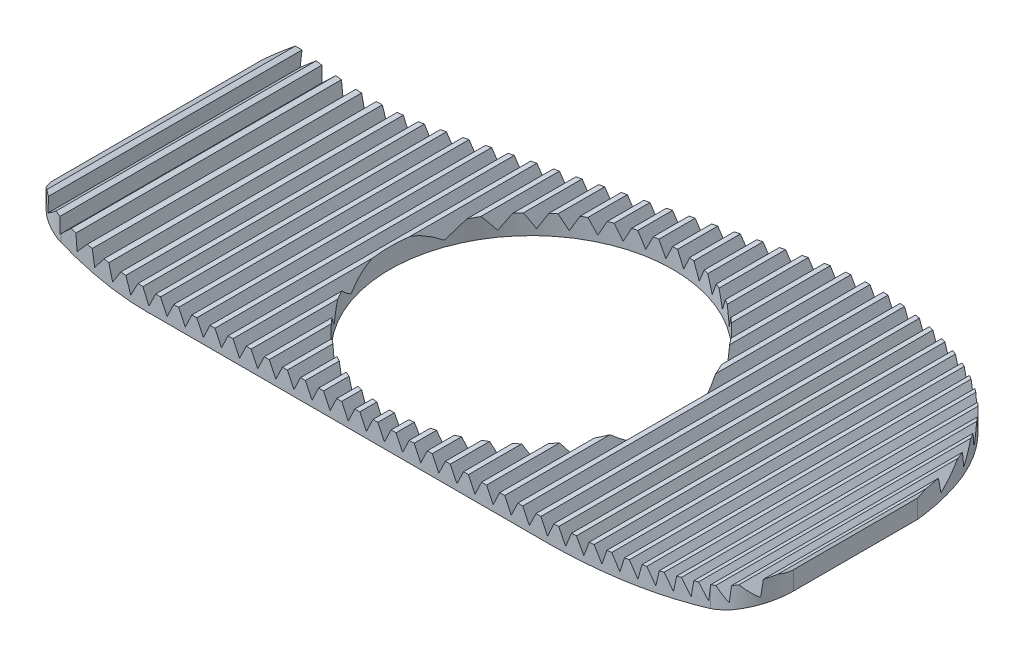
SolidWorks part; units mm, degrees
ref_plane "Front Plane" through (0, 0, 0) normal (0, 0, 1) x (1, 0, 0)
ref_plane "Top Plane" through (0, 0, 0) normal (0, 1, 0) x (1, 0, 0)
ref_plane "Right Plane" through (0, 0, 0) normal (1, 0, 0) x (0, 0, -1)
sketch "Sketch1" plane through (0, 0, 0) normal (0, 0, 1) x (1, 0, 0)
  line L0 (118, 3) -> (40, 3) construction
  line L1 (160, 3) -> (147, 3) construction
  line L2 (147, 3) -> (40, 3)
  line L3 (160, 3) -> (147, 3)
  arc A0 (1.7082, 14.9662) -> (14.5824, 7.9884) centre (40, 70.25) ccw construction
  arc A1 (14.5824, 7.9884) -> (40, 3) centre (40, 70.25) ccw construction
  arc A2 (160, 3) -> (209.8567, 10.3732) centre (160, 175.25) ccw construction
  arc A3 (209.8567, 10.3732) -> (223.8873, 15.286) centre (160, 175.25) ccw construction
  arc A4 (1.7082, 14.9662) -> (14.5824, 7.9884) centre (40, 70.25) ccw
  arc A5 (14.5824, 7.9884) -> (40, 3) centre (40, 70.25) ccw
  arc A6 (160, 3) -> (209.8567, 10.3732) centre (160, 175.25) ccw
  arc A7 (209.8567, 10.3732) -> (223.8873, 15.286) centre (160, 175.25) ccw
curve "CompCurve1"
sketch "Sketch2" plane through (0, 0, 0) normal (0, 0, 1) x (1, 0, 0)
  line L0 (43, 3) -> (43, 9) construction
  line L1 (46, 3) -> (40, 3)
  line L2 (40, 3) -> (40, 4.3)
  line L3 (46, 3) -> (46, 4.3)
  line L4 (40, 4.3) -> (42.25, 9)
  line L5 (46, 4.3) -> (43.75, 9)
  line L6 (42.25, 9) -> (43.75, 9)
  line L7 (40, 3) -> (147, 3) construction
  arc A0 (14.5824, 7.9884) -> (40, 3) centre (40, 70.25) ccw construction
  dimension "D1" = 1.5
  dimension "D2" = 1.3
  dimension "D3" = 6
  dimension "D4" = 6
extrude "Boss-Extrude1" add sketch "Sketch2" against normal blind 130
pattern_curve "CrvPattern1" of "Boss-Extrude1" parameters "D1"=34, "D3"=5.5, "D2"=1, "D4"=10
pattern_curve "CrvPattern2" of "Boss-Extrude1" parameters "D1"=8, "D3"=5.5, "D2"=1, "D4"=10
sketch "Sketch3" plane through (0, 3, 0) normal (0, -1, 0) x (1, 0, 0)
  circle A2 centre (108.3533, -50) radius 43
  circle A3 centre (108.3533, -50) radius 43
  dimension "D1" = 5
extrude "Cut-Extrude1" cut sketch "Sketch3" against normal through all
sketch "Sketch4" plane through (0, 0, 0) normal (0, -1, 0) x (1, 0, 0)
  line L0 (210.7058, -2) -> (210.7061, -1.9999)
  line L1 (40.4774, -87.9996) -> (40.4824, -88.0009)
  line L2 (2, -68.2618) -> (2, -68.2608)
  line L4 (2, -15.0145) -> (2, -15.0112)
  line L47 (132.3919, -110.8446) -> (94.6184, -101.4561)
  line L48 (132.3919, -110.8446) -> (66.4746, -94.4611)
  line L51 (66.4746, -94.4611) -> (40.4824, -88.0009)
  line L52 (66.4746, -94.4611) -> (40.4824, -88.0009)
  line L54 (2, -68.2565) -> (2, -15)
  line L55 (2, -68.2608) -> (2, -15.0145)
  line L57 (14.5824, -2) -> (40, -2)
  line L58 (13.4488, -2) -> (40, -2)
  line L60 (40, -2) -> (147, -2)
  line L61 (40, -2) -> (147, -2)
  line L63 (147, -2) -> (160, -2)
  line L64 (147, -2) -> (160, -2)
  line L66 (160, -2) -> (209.8567, -2)
  line L67 (160, -2) -> (210.7058, -2)
  line L69 (223, -52.8711) -> (223, -15)
  line L70 (223, -52.692) -> (223, -15.0089)
  arc A4 (132.3919, -110.8446) -> (159.7333, -112.3482) centre (150, -40) ccw
  arc A5 (132.3919, -110.8446) -> (159.7333, -112.3482) centre (150, -40) ccw
  spline S24 degree 3 poles (3877.9416, -1212.6896) (1635.6623, -466.1716) (138.8685, -111.4109) (35.3935, -86.7901) (34.8126, -86.6519) (34.0205, -86.4634) (33.7696, -86.4036) (33.4129, -86.3188) (33.2396, -86.2775) (33.0459, -86.2314) (32.9512, -86.2089) (32.9044, -86.1977) (32.8844, -86.193) (32.8745, -86.1906) (32.8712, -86.1898) (32.8646, -86.1883) (32.8634, -86.188) (31.4597, -85.854) (30.1337, -85.5385) (28.2536, -85.0912) (27.645, -84.9464) (26.7593, -84.7356) (26.4686, -84.6665) (26.0393, -84.5643) (25.8263, -84.5136) (25.5808, -84.4552) (25.4588, -84.4262) (25.398, -84.4117) (25.372, -84.4055) (25.3547, -84.4014) (25.3477, -84.3998) (24.0091, -84.0813) (22.7323, -83.7775) (20.8944, -83.3402) (20.2947, -83.1975) (19.4144, -82.988) (18.979, -82.8844) (18.4795, -82.7656) (18.2672, -82.7151) (18.1613, -82.6899) (18.1261, -82.6815) (18.0557, -82.6648) (18.0233, -82.657) (-139.8229, -45.1055) (-95.4265, -60.0611) (4010.1263, -136.3782) knots -10.018547 -10.018547 -10.018547 -10.018547 0.125 0.125 0.1875 0.1875 0.21875 0.21875 0.234375 0.242187 0.246094 0.248047 0.249023 0.249023 0.249512 0.249512 0.25 0.25 0.375 0.375 0.4375 0.4375 0.46875 0.46875 0.484375 0.492187 0.496094 0.498047 0.499023 0.499023 0.5 0.5 0.625 0.625 0.6875 0.6875 0.71875 0.734375 0.742187 0.742187 0.746094 0.746094 0.75 0.75 17.064554 17.064554 17.064554 17.064554 only from (40.4629, -87.9961) to (10.8872, -80.9592)
  spline S25 degree 3 poles (40.4774, -87.9996) (38.7819, -87.5962) (37.2981, -87.2433) (35.3935, -86.7901) (34.8126, -86.6519) (34.0205, -86.4634) (33.7696, -86.4036) (33.4129, -86.3188) (33.2396, -86.2775) (33.0459, -86.2314) (32.9512, -86.2089) (32.9044, -86.1977) (32.8844, -86.193) (32.8745, -86.1906) (32.8712, -86.1898) (32.8646, -86.1883) (32.8634, -86.188) (31.4597, -85.854) (30.1337, -85.5385) (28.2536, -85.0912) (27.645, -84.9464) (26.7593, -84.7356) (26.4686, -84.6665) (26.0393, -84.5643) (25.8263, -84.5136) (25.5808, -84.4552) (25.4588, -84.4262) (25.398, -84.4117) (25.372, -84.4055) (25.3547, -84.4014) (25.3477, -84.3998) (24.0091, -84.0813) (22.7323, -83.7775) (20.8944, -83.3402) (20.2947, -83.1975) (19.4144, -82.988) (18.979, -82.8844) (18.4795, -82.7656) (18.2672, -82.7151) (18.1613, -82.6899) (18.1261, -82.6815) (18.0557, -82.6648) (18.0233, -82.657) (15.5696, -82.0733) (13.2011, -81.5109) (10.8938, -80.9608) knots -0.000356 -0.000356 -0.000356 -0.000356 0.125 0.125 0.1875 0.1875 0.21875 0.21875 0.234375 0.242187 0.246094 0.248047 0.249023 0.249023 0.249512 0.249512 0.25 0.25 0.375 0.375 0.4375 0.4375 0.46875 0.46875 0.484375 0.492187 0.496094 0.498047 0.499023 0.499023 0.5 0.5 0.625 0.625 0.6875 0.6875 0.71875 0.734375 0.742187 0.742187 0.746094 0.746094 0.75 0.75 0.999762 0.999762 0.999762 0.999762
  spline S27 degree 3 number of poles 81 (223.0316, -52.5171) -> (159.7324, -112.3483)
  spline S28 degree 3 number of poles 81 (223, -52.692) -> (159.7333, -112.3482)
  spline S30 degree 3 poles (4193.4608, -442.0507) (197.9885, -221.9659) (223.3272, -31.3928) (222.9936, -14.5617) (222.9903, -14.4605) (222.9755, -14.142) (222.9602, -13.9224) (222.901, -13.2814) (222.8413, -12.8543) (222.6042, -11.587) (222.3686, -10.762) (221.7501, -9.1777) (221.369, -8.4223) (220.475, -7.0075) (219.9617, -6.3474) (218.2611, -4.556) (216.905, -3.608) (214.6856, -2.6499) (213.9132, -2.4065) (212.7323, -2.1632) (212.3337, -2.1022) (211.7314, -2.0406) (211.5315, -2.0253) (211.2334, -2.0106) (211.1347, -2.007) (195.4337, -1.6494) (-10.3028, -26.8577) (-100.4053, 3978.4132) knots -2.391861 -2.391861 -2.391861 -2.391861 0.015625 0.015625 0.03125 0.03125 0.0625 0.0625 0.125 0.125 0.25 0.25 0.375 0.375 0.5 0.5 0.75 0.75 0.875 0.875 0.9375 0.9375 0.96875 0.96875 0.984375 0.984375 3.37997 3.37997 3.37997 3.37997 only from (223.0001, -15.0178) to (210.7035, -1.9999)
  spline S31 degree 3 poles (223, -15.0089) (222.9989, -14.8891) (222.9979, -14.7762) (222.9936, -14.5617) (222.9903, -14.4605) (222.9755, -14.142) (222.9602, -13.9224) (222.901, -13.2814) (222.8413, -12.8543) (222.6042, -11.587) (222.3686, -10.762) (221.7501, -9.1777) (221.369, -8.4223) (220.475, -7.0075) (219.9617, -6.3474) (218.2611, -4.556) (216.905, -3.608) (214.6856, -2.6499) (213.9132, -2.4065) (212.7323, -2.1632) (212.3337, -2.1022) (211.7314, -2.0406) (211.5315, -2.0253) (211.2334, -2.0106) (211.1347, -2.007) (210.9319, -2.0024) (210.823, -2.0012) (210.7061, -1.9999) knots 0.000376 0.000376 0.000376 0.000376 0.015625 0.015625 0.03125 0.03125 0.0625 0.0625 0.125 0.125 0.25 0.25 0.375 0.375 0.5 0.5 0.75 0.75 0.875 0.875 0.9375 0.9375 0.96875 0.96875 0.984375 0.984375 0.999884 0.999884 0.999884 0.999884
  spline S33 degree 3 poles (707.5586, 3919.674) (30.5503, -532.3712) (1.545, -36.9097) (2.0057, -14.588) (2.007, -14.5354) (2.0093, -14.4612) (2.0101, -14.4372) (2.0113, -14.4024) (2.0117, -14.3918) (2.0126, -14.3679) (2.0129, -14.3606) (2.0226, -14.1269) (2.0359, -13.9118) (2.0898, -13.2607) (2.1432, -12.8322) (2.3584, -11.5481) (2.57, -10.7227) (3.1324, -9.1245) (3.4756, -8.3732) (4.2919, -6.954) (4.7537, -6.3056) (5.7952, -5.1159) (6.3602, -4.5913) (7.5952, -3.6665) (8.2477, -3.2796) (9.6426, -2.645) (10.3662, -2.4062) (65.8078, 9.4683) (194.8508, -399.773) (3737.9097, -1428.8756) knots -3.117945 -3.117945 -3.117945 -3.117945 0.015625 0.015625 0.023438 0.023438 0.027344 0.027344 0.029297 0.029297 0.03125 0.03125 0.0625 0.0625 0.125 0.125 0.25 0.25 0.375 0.375 0.5 0.5 0.625 0.625 0.75 0.75 0.875 0.875 9.895906 9.895906 9.895906 9.895906 only from (2, -15.0112) to (13.4488, -2)
  spline S34 degree 3 poles (2, -15.0112) (2.0007, -14.8773) (2.0023, -14.7545) (2.0057, -14.588) (2.007, -14.5354) (2.0093, -14.4612) (2.0101, -14.4372) (2.0113, -14.4024) (2.0117, -14.3918) (2.0126, -14.3679) (2.0129, -14.3606) (2.0226, -14.1269) (2.0359, -13.9118) (2.0898, -13.2607) (2.1432, -12.8322) (2.3584, -11.5481) (2.57, -10.7227) (3.1324, -9.1245) (3.4756, -8.3732) (4.2919, -6.954) (4.7537, -6.3056) (5.7952, -5.1159) (6.3602, -4.5913) (7.5952, -3.6665) (8.2477, -3.2796) (9.6426, -2.645) (10.3662, -2.4062) (11.8816, -2.0816) (12.6537, -2.0001) (13.4488, -2) knots 0 0 0 0 0.015625 0.015625 0.023438 0.023438 0.027344 0.027344 0.029297 0.029297 0.03125 0.03125 0.0625 0.0625 0.125 0.125 0.25 0.25 0.375 0.375 0.5 0.5 0.625 0.625 0.75 0.75 0.875 0.875 1 1 1 1
  spline S36 degree 3 poles (-3663.4153, 1496.5586) (407.8914, -159.6482) (24.9045, -84.6412) (10.5746, -80.8795) (10.5364, -80.8693) (10.484, -80.8549) (10.4673, -80.8503) (10.4437, -80.8437) (10.4373, -80.8419) (10.4199, -80.8369) (10.4172, -80.8362) (10.2432, -80.786) (10.0895, -80.738) (9.6198, -80.5789) (9.3149, -80.4596) (8.4112, -80.0562) (7.8403, -79.7343) (6.2096, -78.604) (5.256, -77.6454) (3.6723, -75.3722) (3.0542, -74.0732) (2.4245, -71.9613) (2.266, -71.2363) (2.1067, -70.1289) (2.0666, -69.7552) (2.0334, -69.2886) (2.0275, -69.1951) (2.02, -69.0545) (2.0178, -69.0079) (2.0136, -68.9135) (2.012, -68.8739) (1.0438, -41.2762) (62.943, 476.5231) (1443.1566, -3789.7112) knots -2.684329 -2.684329 -2.684329 -2.684329 0.015625 0.015625 0.023438 0.023438 0.027344 0.027344 0.029297 0.029297 0.03125 0.03125 0.0625 0.0625 0.125 0.125 0.25 0.25 0.5 0.5 0.75 0.75 0.875 0.875 0.9375 0.9375 0.953125 0.953125 0.960938 0.960938 0.96875 0.96875 5.905252 5.905252 5.905252 5.905252 only from (10.9001, -80.9623) to (2, -68.2494)
  spline S37 degree 3 poles (10.8938, -80.9608) (10.7899, -80.9352) (10.697, -80.9117) (10.5746, -80.8795) (10.5364, -80.8693) (10.484, -80.8549) (10.4673, -80.8503) (10.4437, -80.8437) (10.4373, -80.8419) (10.4199, -80.8369) (10.4172, -80.8362) (10.2432, -80.786) (10.0895, -80.738) (9.6198, -80.5789) (9.3149, -80.4596) (8.4112, -80.0562) (7.8403, -79.7343) (6.2096, -78.604) (5.256, -77.6454) (3.6723, -75.3722) (3.0542, -74.0732) (2.4245, -71.9613) (2.266, -71.2363) (2.1067, -70.1289) (2.0666, -69.7552) (2.0334, -69.2886) (2.0275, -69.1951) (2.02, -69.0545) (2.0178, -69.0079) (2.0136, -68.9135) (2.012, -68.8739) (2.0045, -68.6592) (2.0009, -68.4693) (2, -68.2618) knots 0.00031 0.00031 0.00031 0.00031 0.015625 0.015625 0.023438 0.023438 0.027344 0.027344 0.029297 0.029297 0.03125 0.03125 0.0625 0.0625 0.125 0.125 0.25 0.25 0.5 0.5 0.75 0.75 0.875 0.875 0.9375 0.9375 0.953125 0.953125 0.960938 0.960938 0.96875 0.96875 0.999389 0.999389 0.999389 0.999389
  dimension "D1" = 2
  dimension "D2" = 2
  dimension "D3" = 2
  dimension "D4" = 2
  dimension "D5" = 2
  dimension "D6" = 2
  dimension "D7" = 2
  dimension "D8" = 2
  dimension "D9" = 2
  dimension "D10" = 2
  dimension "D11" = 2
  dimension "D12" = 2
  dimension "D13" = 2
  dimension "D14" = 2
extrude "Cut-Extrude2" cut sketch "Sketch4" against normal through all flip side to cut
